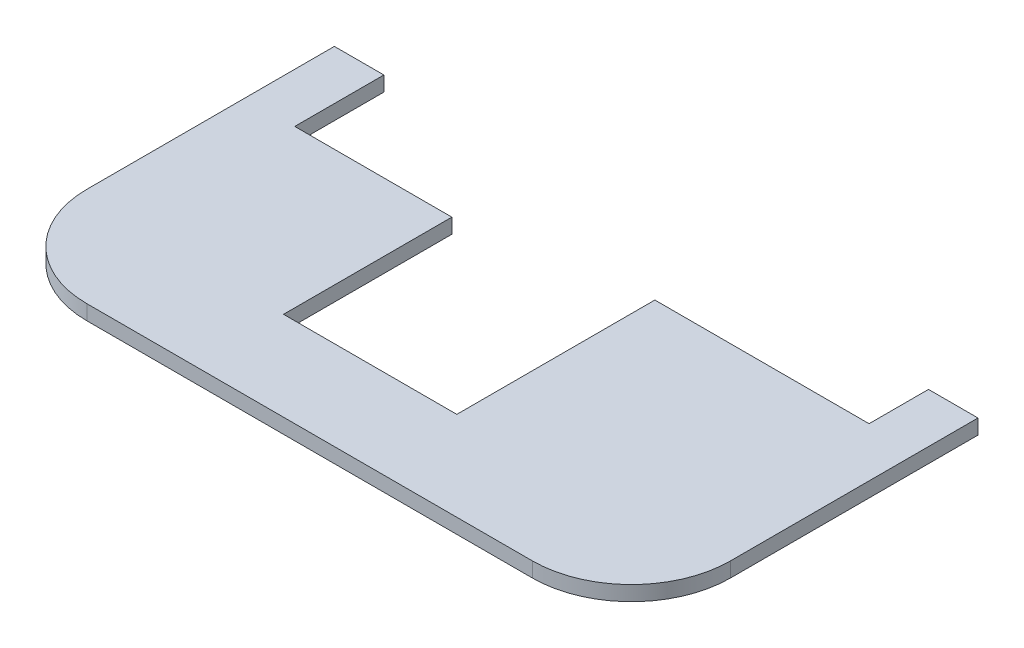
SolidWorks part; units mm, degrees
ref_plane "Alzado" through (0, 0, 0) normal (0, 0, 1) x (1, 0, 0)
ref_plane "Planta" through (0, 0, 0) normal (0, 1, 0) x (1, 0, 0)
ref_plane "Vista lateral" through (0, 0, 0) normal (1, 0, 0) x (0, 0, -1)
sketch "Sketch1" plane through (0, 0, 0) normal (0, 1, 0) x (1, 0, 0)
  line L0 (-10.8181, 35) -> (182.5653, 35) construction
  line L1 (20, 0) -> (110, 0)
  line L2 (0, 20) -> (0, 70)
  line L3 (0, 70) -> (130, 70)
  line L4 (130, 20) -> (130, 70)
  line L6 (24, 41) -> (36, 41) construction
  line L7 (24, 41) -> (24, 29) construction
  line L8 (24, 29) -> (36, 29) construction
  line L9 (36, 41) -> (36, 29) construction
  line L10 (24, 41) -> (36, 29) construction
  line L11 (24, 29) -> (36, 41) construction
  circle A1 centre (94, 35) radius 13 construction
  arc A2 (110, 0) -> (130, 20) centre (110, 20) ccw
  arc A3 (20, 0) -> (0, 20) centre (20, 20) cw
  point P7 (30, 35)
  point P16 (0, 0)
  dimension "D3" = 35
  dimension "D4" = 30
  dimension "D5" = 12
  dimension "D6" = 23
  dimension "D7" = 26
  dimension "D8" = 20
  dimension "D1" = 70
  dimension "D2" = 130
extrude "Boss-Extrude1" add sketch "Sketch1" along normal blind 3
sketch "Sketch2" plane through (0, 3, 0) normal (0, 1, 0) x (1, 0, 0)
  line L0 (130, 70) -> (0, 70) construction
  line L7 (10, 70) -> (120, 70)
  line L8 (10, 70) -> (10, 58)
  line L9 (76.7317, 58) -> (120, 58)
  line L10 (120, 70) -> (120, 58)
  line L11 (0, 70) -> (0, 20) construction
  line L12 (130, 20) -> (130, 70) construction
  line L13 (41.7317, 52) -> (41.7317, 18)
  line L18 (41.7317, 18) -> (76.7317, 18)
  line L19 (76.7317, 58) -> (76.7317, 18)
  line L21 (10, 58) -> (10, 52)
  line L22 (10, 52) -> (41.7317, 52)
  point P0 (94, 35)
  point P16 (30.9007, 35)
  dimension "D1" = 10
  dimension "D2" = 10
  dimension "D3" = 12
  dimension "D4" = 34
  dimension "D5" = 31.7317
  dimension "D6" = 35
  dimension "D7" = 40
  dimension "D8" = 18
extrude "Cut-Extrude1" cut sketch "Sketch2" against normal through all both and the other way through all
